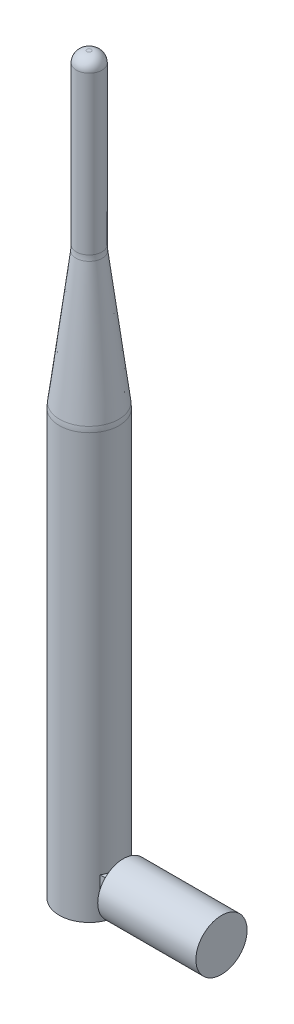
SolidWorks part; units mm, degrees
ref_plane "Front Plane" through (0, 0, 0) normal (0, 0, 1) x (1, 0, 0)
ref_plane "Top Plane" through (0, 0, 0) normal (0, 1, 0) x (1, 0, 0)
ref_plane "Right Plane" through (0, 0, 0) normal (1, 0, 0) x (0, 0, -1)
sketch "Sketch2" plane through (0, 0, 0) normal (0, 0, 1) x (1, 0, 0)
  line L0 (3, 169.5) -> (3, 132.6226)
  line L1 (0, 0) -> (7, 0)
  line L2 (0, 0) -> (0, 172)
  line L3 (0, 172) -> (0.5, 172)
  line L4 (7, 0) -> (7, 99.3774)
  line L5 (3.0772, 131.3822) -> (6.9228, 100.6178)
  arc A0 (3, 169.5) -> (0.5, 172) centre (0.5, 169.5) ccw
  arc A1 (3, 132.6226) -> (3.0772, 131.3822) centre (13, 132.6226) ccw
  arc A2 (6.9228, 100.6178) -> (7, 99.3774) centre (-3, 99.3774) cw
  point P9 (3, 172)
  point P12 (3, 132)
  point P15 (7, 100)
  dimension "D6" = 2.5
  dimension "D7" = 10
  dimension "D1" = 7
  dimension "D2" = 172
  dimension "D3" = 3
  dimension "D4" = 100
  dimension "D5" = 40
revolve "Antenna" add sketch "Sketch2" angle 360 about L2
sketch "Sketch3" plane through (0, 0, 0) normal (0, 0, 1) x (1, 0, 0)
  line L0 (7, 0) -> (7, 99.3774) construction
  line L1 (8, 0) -> (31, 0)
  line L2 (8, 0) -> (8, 6)
  line L3 (8, 6) -> (31, 6)
  line L4 (31, 0) -> (31, 6)
  dimension "D1" = 23
  dimension "D2" = 6
  dimension "D3" = 1
revolve "Revolve2" add sketch "Sketch3" angle 360 about L3
sketch "Sketch4" plane through (8, 0, 0) normal (-1, 0, 0) x (0, 0, 1)
  line L1 (3.5, 2.5) -> (-3.5, 2.5)
  line L2 (3.5, 2.5) -> (3.5, 9.5)
  line L3 (3.5, 9.5) -> (-3.5, 9.5)
  line L4 (-3.5, 2.5) -> (-3.5, 9.5)
  point P4 (0, 2.5)
  point P6 (3.5, 6)
  dimension "D1" = 7
  dimension "D2" = 7
  dimension "D3" = 6
extrude "Boss-Extrude2" add sketch "Sketch4" along normal blind 10
